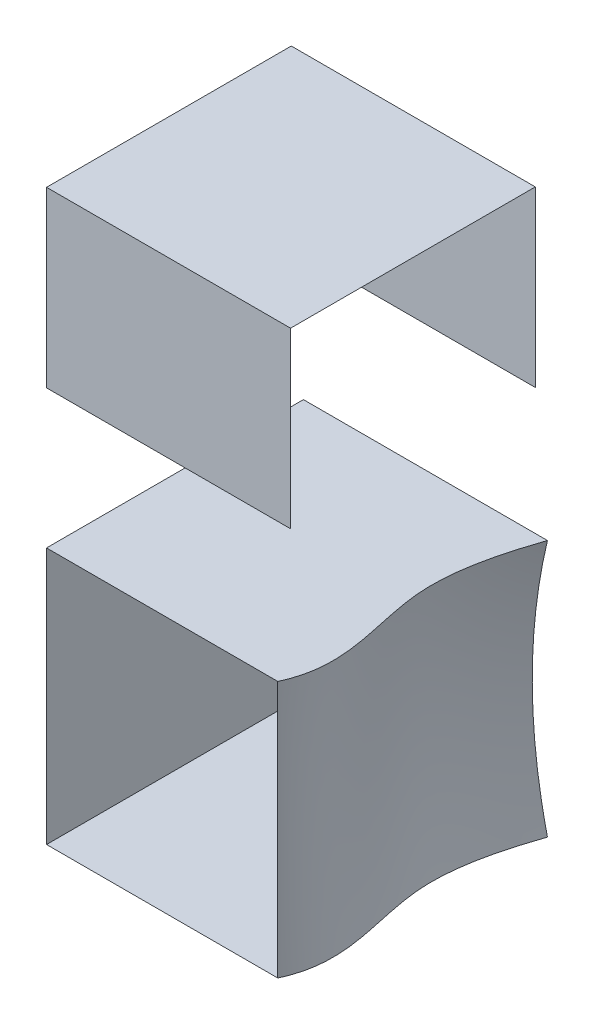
SolidWorks part; units mm, degrees
ref_plane "Front Plane" through (0, 0, 0) normal (0, 0, 1) x (1, 0, 0)
ref_plane "Top Plane" through (0, 0, 0) normal (0, 1, 0) x (1, 0, 0)
ref_plane "Right Plane" through (0, 0, 0) normal (1, 0, 0) x (0, 0, -1)
sketch "Sketch1" plane through (0, 0, 0) normal (0, 0, 1) x (1, 0, 0)
  line L1 (0, 0) -> (100, 0)
  line L2 (0, 0) -> (0, -100)
  line L3 (0, -100) -> (100, -100)
  line L4 (100, 0) -> (100, -100)
  dimension "D1" = 100
  dimension "D2" = 100
surface "Surface-Plane1" sketch "Sketch1"
sketch "Sketch2" plane through (0, 0, 0) normal (1, 0, 0) x (0, 0, -1)
  line L1 (0, 0) -> (100, 0)
  line L2 (0, 0) -> (0, -100)
  line L3 (0, -100) -> (100, -100)
  line L4 (100, 0) -> (100, -100)
  dimension "D1" = 100
  dimension "D2" = 100
surface "Surface-Plane2" sketch "Sketch2"
sketch "Sketch3" plane through (0, 0, 0) normal (0, 1, 0) x (1, 0, 0)
  line L1 (0, 0) -> (100, 0)
  line L2 (0, 0) -> (0, 100)
  line L3 (0, 100) -> (100, 100)
  line L4 (100, 0) -> (100, 100)
  dimension "D1" = 100
  dimension "D2" = 100
surface "Surface-Plane3" sketch "Sketch3"
ref_plane "Plane1" through (0, -100, 0) normal (0, 1, 0) x (1, 0, 0)
sketch "Sketch4" plane through (0, -100, 0) normal (0, 1, 0) x (1, 0, 0)
  line L1 (0, 0) -> (100, 0)
  line L2 (0, 0) -> (0, 100)
  line L3 (0, 100) -> (100, 100)
  line L4 (100, 0) -> (100, 100)
  dimension "D1" = 100
  dimension "D2" = 100
surface "Surface-Plane4" sketch "Sketch4"
ref_plane "Plane2" through (100, -100, 0) normal (1, 0, 0) x (0, 0, -1)
sketch "Sketch10" plane through (0, 0, 0) normal (0, 1, 0) x (1, 0, 0)
  line L0 (100, 100) -> (0, 100) construction
  line L1 (100, 0) -> (0, 0) construction
  line L2 (95, 100) -> (100, 100)
  line L3 (100, 100) -> (100, 0)
  line L4 (100, 0) -> (100, 100) construction
  line L5 (100, 0) -> (90, 0)
  spline S0 degree 3 poles (95, 100) (90.4462, 86.6392) (81.4959, 52.279) (99.2121, 19.4577) (90, 0) knots 0 0 0 0 0.422366 1 1 1 1
  dimension "D1" = 10
  dimension "D2" = 5
surface "Surface-Trim1"
sketch3d "3DSketch1"
  spline S0 degree 2 poles (95, 0, -100) (83.1539, -49.757, -100) (95, -100, -100) knots 0 0 0 1 1 1
other "Boundary-Surface1"
delete or keep bodies "Body-Delete/Keep 1" type delete bodies bodies 130
sketch "Sketch11" plane through (0, 0, 0) normal (1, 0, 0) x (0, 0, -1)
  line L0 (0, 53.9502) -> (0, 121.5791)
  line L1 (0, 121.5791) -> (95.268, 121.5791)
  line L2 (95.268, 121.5791) -> (95.268, 53.9502)
surface "Surface-Extrude1" sketch "Sketch11" parameters "D1"=95
